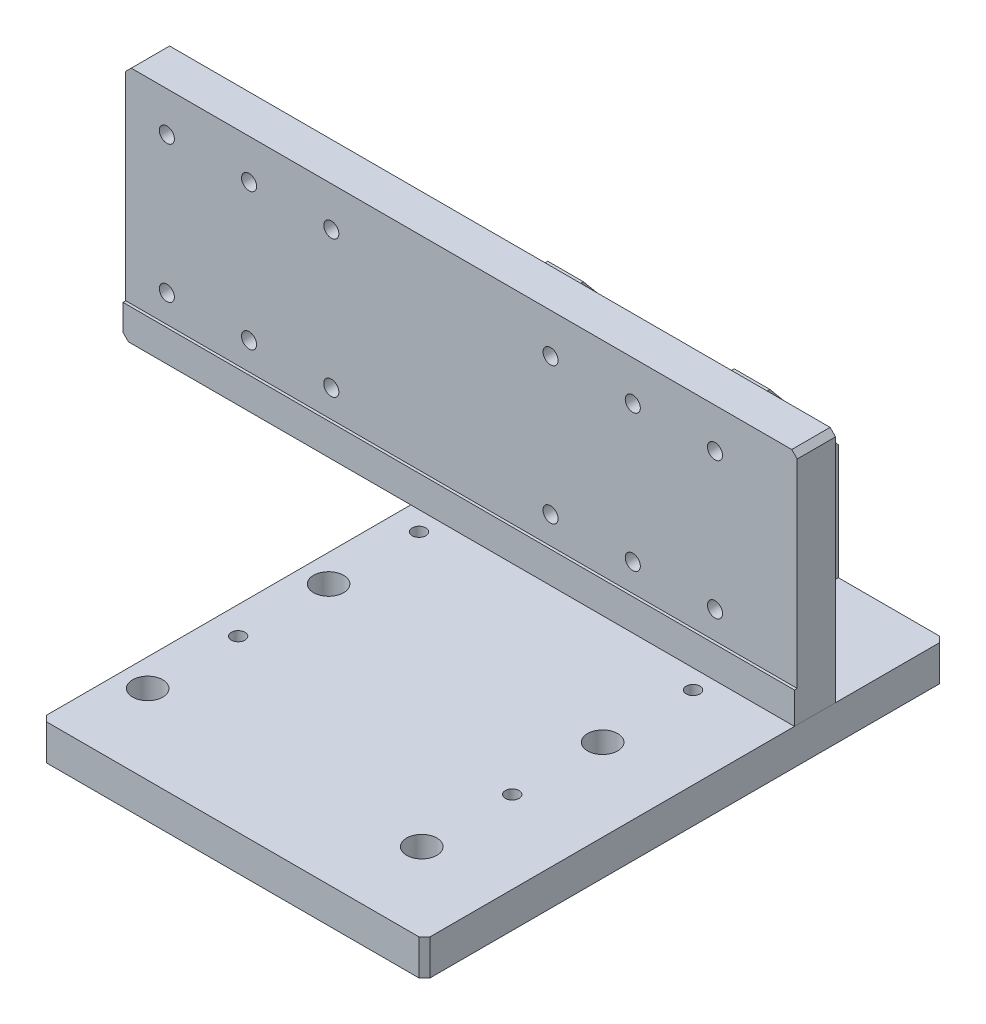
SolidWorks part; units mm, degrees
ref_plane "정면" through (0, 0, 0) normal (0, 0, 1) x (1, 0, 0)
ref_plane "윗면" through (0, 0, 0) normal (0, 1, 0) x (1, 0, 0)
ref_plane "우측면" through (0, 0, 0) normal (1, 0, 0) x (0, 0, -1)
sketch "스케치1" plane through (0, 0, 0) normal (0, 1, 0) x (1, 0, 0)
  line L1 (-70, 95) -> (70, 95)
  line L2 (-70, 95) -> (-70, -95)
  line L3 (-70, -95) -> (70, -95)
  line L4 (70, 95) -> (70, -95)
  line L5 (-70, 95) -> (70, -95) construction
  line L6 (-70, -95) -> (70, 95) construction
  point P0 (0, 0)
  dimension "D1" = 190
  dimension "D2" = 140
extrude "보스-돌출1" add sketch "스케치1" along normal blind 13
sketch "스케치2" plane through (0, 13, 0) normal (0, 1, 0) x (1, 0, 0)
  line L0 (70, -95) -> (70, 95) construction
  line L1 (70, 55) -> (-175, 55)
  line L2 (70, 55) -> (70, 40)
  line L3 (70, 40) -> (-175, 40)
  line L4 (-175, 55) -> (-175, 40)
  line L5 (70, 95) -> (-70, 95) construction
  dimension "D1" = 245
  dimension "D2" = 15
  dimension "D3" = 40
extrude "보스-돌출3" add sketch "스케치2" along normal blind 86 separate body
sketch "스케치3" plane through (0, 0, -40) normal (0, 0, 1) x (1, 0, 0)
  line L0 (70, 99) -> (70, 13) construction
  line L1 (-175, 99) -> (70, 99)
  line L2 (-175, 99) -> (-175, 24.5)
  line L3 (-175, 24.5) -> (70, 24.5)
  line L4 (70, 99) -> (70, 24.5)
  line L5 (-175, 13) -> (70, 13) construction
  dimension "D1" = 11.5
extrude "컷-돌출1" cut sketch "스케치3" against normal blind 1
sketch "스케치4" plane through (0, 13, 0) normal (0, 1, 0) x (1, 0, 0)
  line L0 (70, 95) -> (-70, 95) construction
  line L1 (70, 55) -> (-175, 55) construction
  line L2 (-50, 95) -> (-37, 95)
  line L3 (-50, 95) -> (-50, 55)
  line L4 (-50, 55) -> (-37, 55)
  line L5 (-37, 95) -> (-37, 55)
  line L6 (-70, 95) -> (-70, -95) construction
  line L7 (18, 95) -> (31, 95)
  line L8 (18, 95) -> (18, 55)
  line L9 (18, 55) -> (31, 55)
  line L10 (31, 95) -> (31, 55)
  dimension "D1" = 20
  dimension "D2" = 13
  dimension "D3" = 55
extrude "보스-돌출4" add sketch "스케치4" along normal blind 72 separate body
sketch "스케치5" plane through (-50, 0, 0) normal (-1, 0, 0) x (0, 0, 1)
  line L0 (-95, 85) -> (-95, 55)
  line L1 (-95, 85) -> (-95, 13) construction
  line L2 (-95, 55) -> (-70, 85)
  line L3 (-95, 85) -> (-55, 85) construction
  line L4 (-70, 85) -> (-95, 85)
  dimension "D1" = 25
  dimension "D2" = 30
extrude "컷-돌출2" cut sketch "스케치5" against normal through all
hole_wizard "M6 소켓 머리 캡 나사용 카운터보어1" positions "스케치6" profile "스케치7" counterbore size "M6" standard "KS"
sketch "스케치6" plane through (0, 13, 0) normal (0, 1, 0) x (1, 0, 0)
  line L1 (70, 95) -> (-70, 95) construction
  line L2 (-70, 95) -> (-70, -95) construction
  point P0 (-60, 66)
  point P2 (40, 66)
  point P20 (0, 0)
  point P21 (-60, 0)
  point P22 (-60, -66)
  point P23 (40, -66)
  point P24 (40, 0)
  point P25 (-60, 0)
  point P26 (40, 0)
  point P27 (40, -66)
  dimension "D1" = 100
  dimension "D2" = 10
  dimension "D3" = 29
  dimension "D4" = 66
  dimension "D5" = 66
sketch "스케치7" plane through (-60, 13, -66) normal (1, 0, 0) x (0, 0, 1)
  line L0 (0, 0) -> (0, 13)
  line L1 (0, 13) -> (3.3, 13)
  line L3 (3.3, 13) -> (3.3, 8)
  line L4 (3.3, 8) -> (5.5, 8)
  line L5 (5.5, 8) -> (5.5, 0)
  line L7 (5.5, 0) -> (0, 0)
  line L11 (0, -6.35) -> (0, 107.95) construction
  dimension "관통 구멍 지름" = 6.6
  dimension "관통 구멍 깊이" = 13
  dimension "카운터보어 지름" = 11
  dimension "카운터보어 깊이" = 8
hole_wizard "Ø5.0mm 맞춤핀 구멍1" positions "스케치8" profile "스케치9" hole size "Ø5.0" standard "ISO"
sketch "스케치8" plane through (0, 13, 0) normal (0, 1, 0) x (1, 0, 0)
  line L0 (70, 95) -> (-70, 95) construction
  line L1 (-70, 95) -> (-70, -95) construction
  point P0 (-60, 33)
  point P2 (40, 33)
  point P4 (-60, -33)
  point P6 (40, -33)
  dimension "D1" = 66
  dimension "D2" = 62
  dimension "D3" = 100
  dimension "D4" = 10
sketch "스케치9" plane through (-60, 13, -33) normal (1, 0, 0) x (0, 0, 1)
  line L0 (0, 0) -> (0, 13)
  line L1 (0, 13) -> (2.5, 13)
  line L2 (2.5, 13) -> (2.5, 0)
  line L5 (2.5, 0) -> (0, 0)
  line L11 (0, -6.35) -> (0, 107.95) construction
  dimension "관통 구멍 지름" = 5
  dimension "관통 구멍 깊이" = 13
hole_wizard "M5 소켓 머리 캡 나사용 카운터보어1" positions "스케치10" profile "스케치11" counterbore size "M5" standard "KS"
sketch "스케치10" plane through (0, 0, -55) normal (0, 0, -1) x (-1, 0, 0)
  line L0 (-70, 99) -> (-70, 13) construction
  line L1 (-70, 13) -> (70, 13) construction
  point P0 (-40, 84.5)
  point P2 (-10, 84.5)
  point P4 (20, 84.5)
  point P6 (-40, 34.5)
  point P8 (-10, 34.5)
  point P10 (20, 34.5)
  dimension "D1" = 30
  dimension "D2" = 30
  dimension "D3" = 30
  dimension "D4" = 21.5
  dimension "D5" = 50
sketch "스케치11" plane through (40, 84.5, -55) normal (1, 0, 0) x (0, 1, 0)
  line L0 (0, 0) -> (0, 150)
  line L1 (0, 150) -> (2.75, 150)
  line L3 (2.75, 150) -> (2.75, 8)
  line L4 (2.75, 8) -> (4.75, 8)
  line L5 (4.75, 8) -> (4.75, 0)
  line L7 (4.75, 0) -> (0, 0)
  line L11 (0, -6.35) -> (0, 107.95) construction
  dimension "관통 구멍 지름" = 5.5
  dimension "관통 구멍 깊이" = 150
  dimension "카운터보어 지름" = 9.5
  dimension "카운터보어 깊이" = 8
chamfer "모따기1" distance 2 angle 45 3 edges at (-175, 13, -47.5) (-175, 99, -48) (70, 99, -48)
chamfer "모따기2" distance 2 angle 45 4 edges at (70, 6.5, -95) (-70, 6.5, -95) (70, 6.5, 95) (-70, 6.5, 95)
pattern_linear "선형 패턴1" count 2 spacing 140 along (-1, 0, 0) of "M5 소켓 머리 캡 나사용 카운터보어1"
